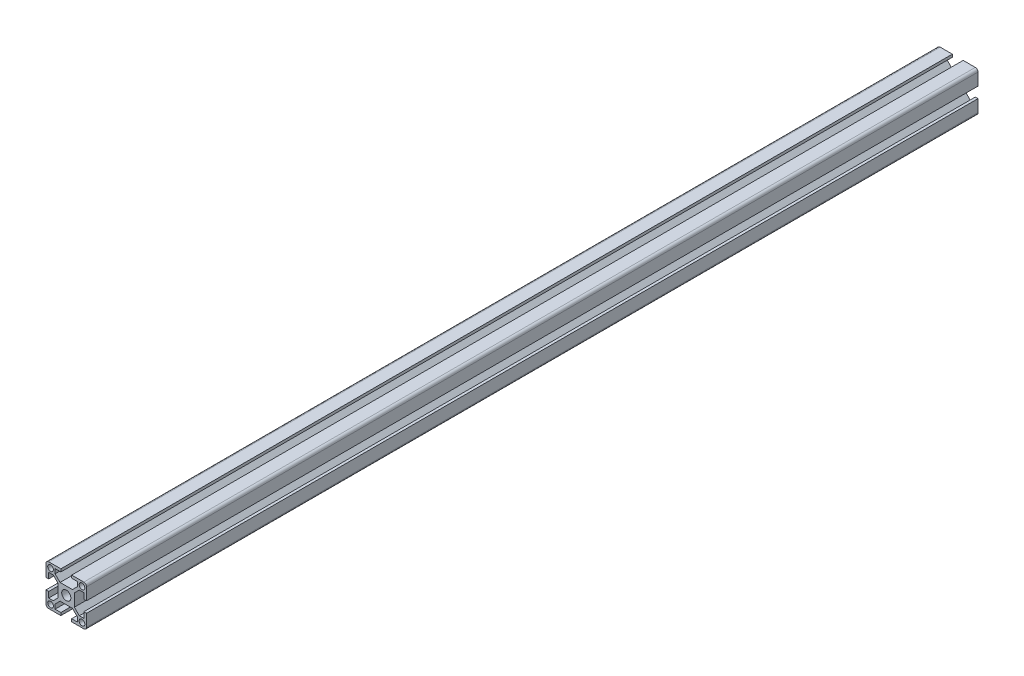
SolidWorks part; units mm, degrees
ref_plane "前视基准面" through (0, 0, 0) normal (0, 0, 1) x (1, 0, 0)
ref_plane "上视基准面" through (0, 0, 0) normal (0, 1, 0) x (1, 0, 0)
ref_plane "右视基准面" through (0, 0, 0) normal (1, 0, 0) x (0, 0, -1)
sketch "草图1" plane through (0, 0, 0) normal (0, 0, 1) x (1, 0, 0)
  line L0 (-15, -4) -> (-15, -13)
  line L1 (-13, 15) -> (-4, 15)
  line L2 (-15, 13) -> (-15, 4)
  line L3 (-13, -15) -> (-4, -15)
  line L4 (15, 13) -> (15, 4)
  line L5 (-15, 15) -> (15, -15) construction
  line L6 (-15, -15) -> (15, 15) construction
  line L7 (-8.25, 13) -> (-4, 13)
  line L8 (-8.25, 9.6642) -> (-8.25, 13)
  line L9 (-4.5858, 6) -> (-8.25, 9.6642)
  line L10 (6, 4.5858) -> (6, -4.5858)
  line L11 (-6, 6) -> (6, -6) construction
  line L12 (-6, -6) -> (6, 6) construction
  line L13 (4, 15) -> (13, 15)
  line L14 (8.25, -9.6642) -> (8.25, -13)
  line L15 (4.5858, -6) -> (8.25, -9.6642)
  line L16 (0, 0) -> (19.2057, 0) construction
  line L17 (-4.5858, 6) -> (4.5858, 6)
  line L18 (6, 4.5858) -> (9.6642, 8.25)
  line L19 (13, 8.25) -> (13, 4)
  line L20 (4.5858, 6) -> (8.25, 9.6642)
  line L21 (8.25, 9.6642) -> (8.25, 13)
  line L22 (15, -4) -> (15, -13)
  line L23 (4, 13) -> (8.25, 13)
  line L24 (4, 13) -> (4, 15)
  line L25 (-4, 13) -> (-4, 15)
  line L26 (6, -4.5858) -> (9.6642, -8.25)
  line L27 (13, -4) -> (13, -8.25)
  line L28 (13, -4) -> (15, -4)
  line L29 (13, 4) -> (15, 4)
  line L30 (9.6642, -8.25) -> (13, -8.25)
  line L31 (-4.5858, -6) -> (4.5858, -6)
  line L32 (-4.5858, -6) -> (-8.25, -9.6642)
  line L33 (9.6642, 8.25) -> (13, 8.25)
  line L34 (-8.25, -9.6642) -> (-8.25, -13)
  line L35 (-13, -8.25) -> (-13, -4)
  line L36 (-9.6642, -8.25) -> (-13, -8.25)
  line L37 (-6, -4.5858) -> (-9.6642, -8.25)
  line L38 (-6, -4.5858) -> (-6, 4.5858)
  line L39 (-6, 4.5858) -> (-9.6642, 8.25)
  line L40 (-9.6642, 8.25) -> (-13, 8.25)
  line L41 (-13, 4) -> (-13, 8.25)
  line L42 (-13, 4) -> (-15, 4)
  line L43 (-13, -4) -> (-15, -4)
  line L44 (0, 0) -> (6, 4.5858) construction
  line L45 (0, 0) -> (-4.5858, 6) construction
  line L46 (-4, -13) -> (-4, -15)
  line L47 (-8.25, -13) -> (-4, -13)
  line L48 (4, -13) -> (4, -15)
  line L49 (4, -13) -> (8.25, -13)
  line L50 (4, -15) -> (13, -15)
  circle A0 centre (0, 0) radius 36.5532 construction
  circle A1 centre (11.625, 11.625) radius 2.1
  circle A2 centre (-11.625, 11.625) radius 2.1
  circle A3 centre (11.625, -11.625) radius 2.1
  circle A4 centre (-11.625, -11.625) radius 2.1
  circle A5 centre (0, 0) radius 3.4
  arc A6 (-15, -13) -> (-13, -15) centre (-13, -13) ccw
  arc A7 (13, -15) -> (15, -13) centre (13, -13) ccw
  arc A8 (13, 15) -> (15, 13) centre (13, 13) cw
  arc A9 (-13, 15) -> (-15, 13) centre (-13, 13) ccw
  point P0 (0, 0)
  point P6 (0, 0)
  point P11 (-14.2929, -15.7071)
  point P12 (15.7071, 14.2929)
  point P15 (-15.7071, -13.725)
  point P16 (14.2929, 15.7071)
  point P17 (-14.2929, 15.7071)
  point P18 (15.7071, -14.2929)
  point P21 (0, -8.25)
  point P22 (19.2057, -8.25)
  point P23 (0, 8.25)
  point P24 (19.2057, 8.25)
  point P27 (0, -4)
  point P28 (19.2057, -4)
  point P29 (0, 4)
  point P30 (19.2057, 4)
  point P72 (-8.25, -9.6642)
  point P74 (8.25, -9.6642)
  dimension "D7" = 4.2
  dimension "D8" = 4.2
  dimension "D10" = 3.375
  dimension "D17" = 6.8
  dimension "D18" = 2
  dimension "D1" = 30
  dimension "D2" = 30
  dimension "D3" = 3
  dimension "D4" = 6.75
  dimension "D9" = 2
  dimension "D5" = 6.75
  dimension "D6" = 3.375
extrude "凸台-拉伸1" add sketch "草图1" along normal blind 660
